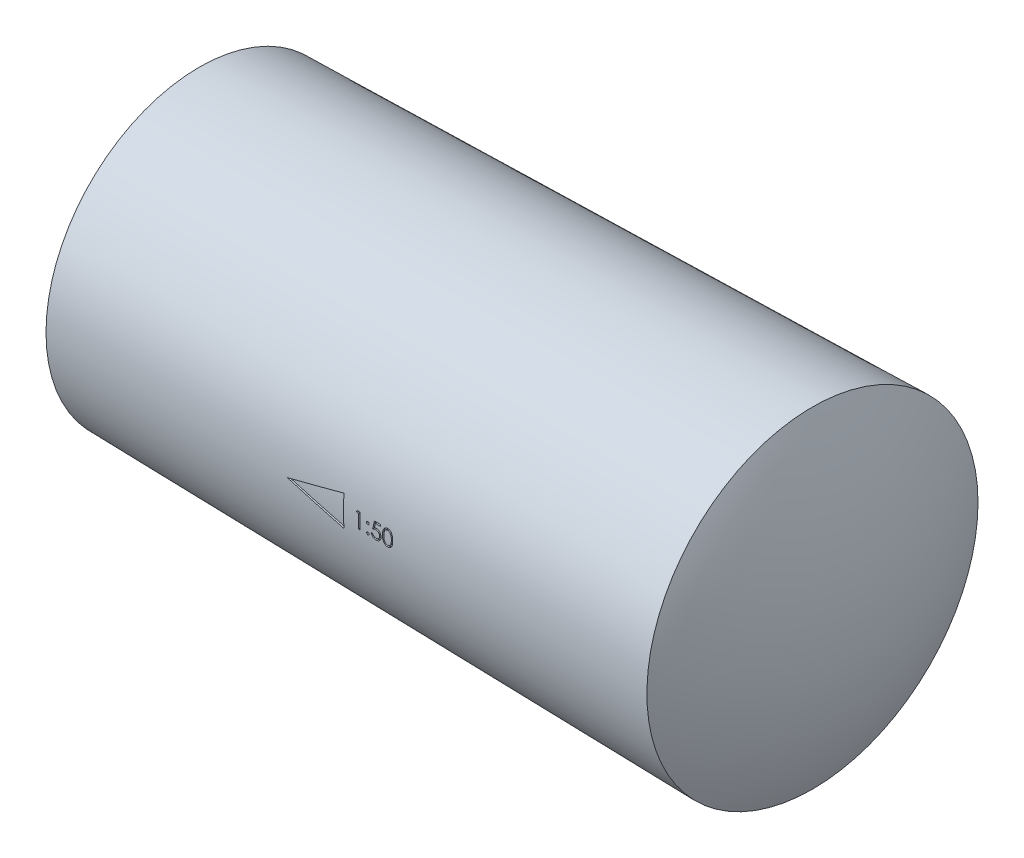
SolidWorks part; units mm, degrees
ref_plane "Front Plane" through (0, 0, 0) normal (0, 0, 1) x (1, 0, 0)
ref_plane "Top Plane" through (0, 0, 0) normal (0, 1, 0) x (1, 0, 0)
ref_plane "Right Plane" through (0, 0, 0) normal (1, 0, 0) x (0, 0, -1)
sketch "Sketch1" plane through (0, 0, 0) normal (1, 0, 0) x (0, 0, -1)
  circle A0 centre (0, 0) radius 10
  dimension "D1" = 20
extrude "Extrude1" add sketch "Sketch1" along normal mid plane 40
draft "Draft1" type of draft neutral plane draft angle 1.146 faces to draft 1 parameters "D1"=1.146
sketch "Sketch2" plane through (0, 0, 0) normal (0, 0, 1) x (1, 0, 0)
  line L0 (-20, 0) -> (-20, 10)
  line L1 (-20, 10) -> (-20, -10) construction
  line L2 (-20, 0) -> (-22.5, 0)
  line L3 (-22.5, 0) -> (-22.5, -10.4) construction
  line L4 (20, 0) -> (20, 10.8)
  line L5 (20, -10.8) -> (20, 10.8) construction
  line L6 (20, 0) -> (22.5, 0)
  line L7 (22.5, 0) -> (22.5, -10.4) construction
  line L8 (-20, -10) -> (20, -10.8) construction
  arc A0 (-22.5, 0) -> (-20, 10) centre (-1.25, 0) cw
  arc A1 (22.5, 0) -> (20, 10.8) centre (-2.0781, 0) ccw
  point P14 (0, -10.4)
revolve "Revolve1" add sketch "Sketch2" angle 360 about L2
sketch "Sketch5" plane through (0, 0, 0) normal (0, 0, 1) x (1, 0, 0)
  line L0 (0, 10.4) -> (0, -10.4) construction
  line L1 (20, 10.8) -> (-20, 10) construction
  line L2 (-20, -10) -> (20, -10.8) construction
ref_plane "Plane2" through (0, 0, 0) normal (-0.02, 0, 0.9998) x (0.9998, 0, 0.02)
sketch "Sketch6" plane through (0, 0, 0) normal (-0.02, 0, 0.9998) x (0.9998, 0, 0.02)
  line L0 (0, 0) -> (0, 1)
  line L1 (0, 10.4) -> (0, -10.4) construction
  line L2 (0, 1) -> (-3.7321, 0)
  line L3 (-3.7321, 0) -> (0, -1)
  line L4 (0, -1) -> (0, 0)
  line L5 (0, -0.5) -> (4, -0.5) construction
  text T0 "1:50" font "Century Gothic" height 1
  dimension "D1" = 2
  dimension "D2" = 30
  dimension "D3" = 4
wrap "Wrap2" sketch "Sketch6" wrap type deboss source sketch "Sketch6" thickness 0.1 parameters "D1"=0.1
equation "\"D2@Sketch2\" = \"D1@Sketch2\""
